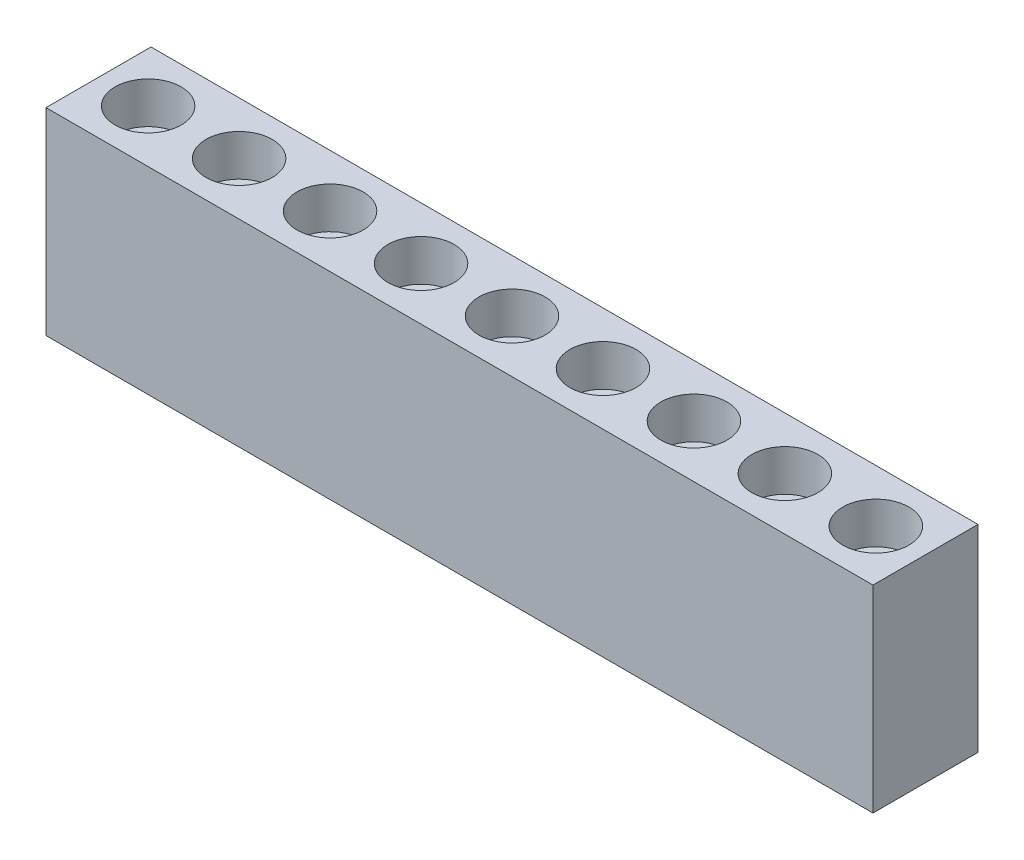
SolidWorks part; units mm, degrees
ref_plane "Front Plane" through (0, 0, 0) normal (0, 0, 1) x (1, 0, 0)
ref_plane "Top Plane" through (0, 0, 0) normal (0, 1, 0) x (1, 0, 0)
ref_plane "Right Plane" through (0, 0, 0) normal (1, 0, 0) x (0, 0, -1)
sketch "Sketch1" plane through (0, 0, 0) normal (0, 0, 1) x (1, 0, 0)
  line L1 (100, -23.875) -> (-100, -23.875)
  line L2 (100, -23.875) -> (100, 23.875)
  line L3 (100, 23.875) -> (-100, 23.875)
  line L4 (-100, -23.875) -> (-100, 23.875)
  line L5 (100, -23.875) -> (-100, 23.875) construction
  line L6 (100, 23.875) -> (-100, -23.875) construction
  point P0 (0, 0)
  dimension "D1" = 200
  dimension "D2" = 47.75
extrude "Boss-Extrude1" add sketch "Sketch1" along normal mid plane 25.4
sketch "Sketch2" plane through (0, 0, 0) normal (0, 0, 1) x (1, 0, 0)
  line L0 (0, 32.0168) -> (0, -37.0588) construction
sketch "Sketch3" plane through (0, 0, 12.7) normal (0, 0, 1) x (1, 0, 0)
  line L0 (-100, 23.875) -> (-100, -23.875) construction
  line L1 (-100, -23.875) -> (100, -23.875) construction
  circle A0 centre (-49.275, -0.005) radius 7.5
  circle A1 centre (49.275, -0.005) radius 7.5
  point P9 (-49.275, -0.005)
  point P10 (49.275, -0.005)
  dimension "D4" = 15
  dimension "D1" = 98.55
  dimension "D2" = 50.725
  dimension "D3" = 23.87
extrude "Cut-Extrude1" [suppressed] cut sketch "Sketch3" against normal up to surface (25.4 mm away)
sketch "Sketch4" plane through (0, 0, 12.7) normal (0, 0, 1) x (1, 0, 0)
  line L0 (-100, 23.875) -> (-100, -23.875) construction
  line L1 (-100, -23.875) -> (100, -23.875) construction
  circle A0 centre (-74.275, -0.005) radius 9
  circle A1 centre (24.275, -0.005) radius 9
  point P9 (24.275, -0.005)
  point P10 (-74.275, -0.005)
  dimension "D1" = 18
  dimension "D2" = 98.55
  dimension "D3" = 25.725
  dimension "D4" = 23.87
extrude "Cut-Extrude2" [suppressed] cut sketch "Sketch4" against normal blind 5
sketch "Sketch5" [suppressed] plane through (0, 0, 7.7) normal (0, 0, 1) x (1, 0, 0)
  circle A0 centre (-49.275, -0.005) radius 6
  circle A1 centre (49.275, -0.005) radius 6
  dimension "D1" = 12
extrude "Cut-Extrude3" [suppressed] cut sketch "Sketch5" against normal up to surface (20.4 mm away)
sketch "Sketch6" plane through (0, 23.875, 0) normal (0, 1, 0) x (1, 0, 0)
  line L0 (-100, -12.7) -> (-100, 12.7) construction
  circle A0 centre (-88, 0) radius 8
  point P2 (0, 0)
  point P6 (-88, 0)
  dimension "D1" = 16
  dimension "D2" = 12
extrude "Cut-Extrude4" cut sketch "Sketch6" against normal blind 10
sketch "Sketch7" plane through (0, 13.875, 0) normal (0, 1, 0) x (1, 0, 0)
  circle A0 centre (-88, 0) radius 4
  dimension "D1" = 8
extrude "Cut-Extrude5" cut sketch "Sketch7" against normal up to surface (37.75 mm away)
pattern_linear "LPattern1" count 9 spacing 22 along (1, 0, 0) of "Cut-Extrude4", "Cut-Extrude5"
